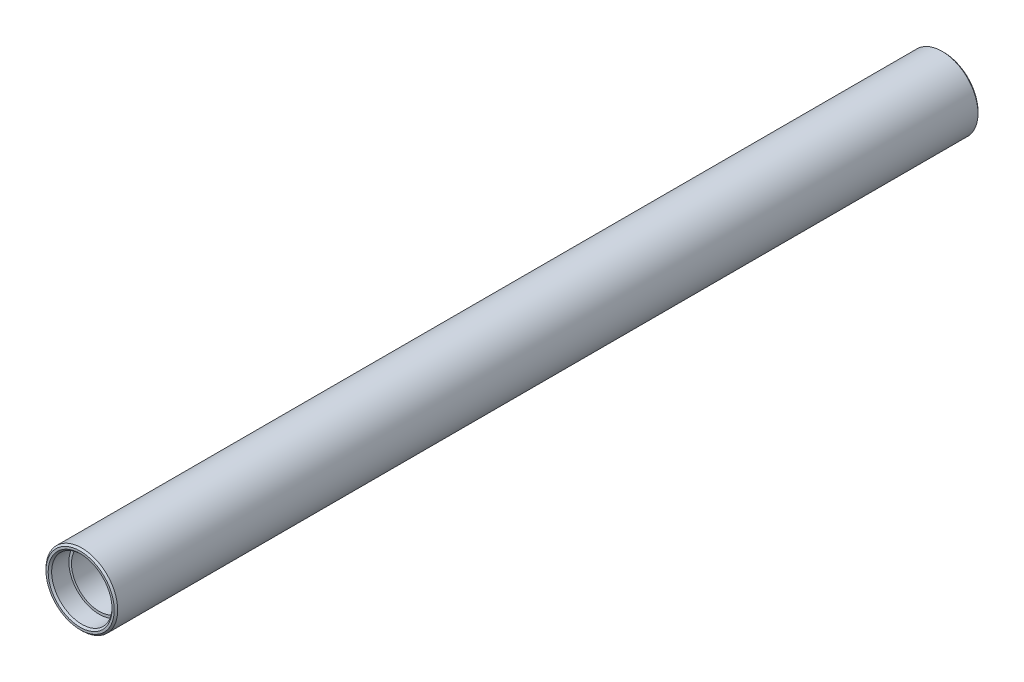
SolidWorks part; units mm, degrees
ref_plane "Plan de face" through (0, 0, 0) normal (0, 0, 1) x (1, 0, 0)
ref_plane "Plan de dessus" through (0, 0, 0) normal (0, 1, 0) x (1, 0, 0)
ref_plane "Plan de droite" through (0, 0, 0) normal (1, 0, 0) x (0, 0, -1)
sketch "Esquisse1" plane through (0, 0, 0) normal (0, 0, 1) x (1, 0, 0)
  circle A0 centre (0, 0) radius 20.75
  circle A1 centre (0, 0) radius 16
  dimension "D1" = 41.5
  dimension "D2" = 32
extrude "Extrusion1" add sketch "Esquisse1" along normal blind 250
sketch "Esquisse2" plane through (0, 0, 0) normal (0, 0, -1) x (-1, 0, 0)
  circle A0 centre (0, 0) radius 17.5
  dimension "D1" = 35
extrude "Enlèv. mat.-Extru.1" cut sketch "Esquisse2" against normal blind 11
chamfer "Chanfrein1" distance 1 angle 45 2 edges at (-17.5, 0, 0) (20.75, 0, 0)
mirror "Symétrie1" about plane through (0, 0, 250) normal (0, 0, 1) of "Enlèv. mat.-Extru.1", "Chanfrein1", "Extrusion1"
